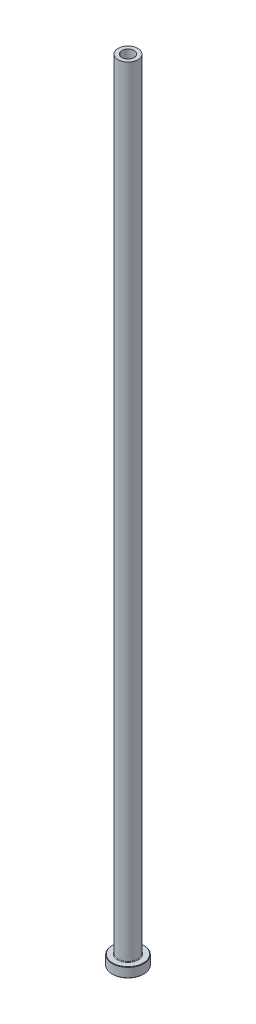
SolidWorks part; units mm, degrees
ref_plane "Front Plane" through (0, 0, 0) normal (0, 0, 1) x (1, 0, 0)
ref_plane "Top Plane" through (0, 0, 0) normal (0, 1, 0) x (1, 0, 0)
ref_plane "Right Plane" through (0, 0, 0) normal (1, 0, 0) x (0, 0, -1)
sketch "Sketch1" plane through (0, 0, 0) normal (0, 0, 1) x (1, 0, 0)
  line L0 (-3.1, 400) -> (-5, 400)
  line L1 (-5, 400) -> (-5, 5)
  line L2 (-5, 5) -> (-8, 5)
  line L3 (-8, 5) -> (-8, 0)
  line L4 (8.8, 0) -> (-8.8, 0) construction
  line L5 (-8, 0) -> (-3.35, 0)
  line L6 (-3.1, 355) -> (-3.1, 400)
  line L7 (0, 92.1877) -> (0, -15.5353) construction
  line L8 (0, -8.8) -> (0, 8.8) construction
  line L9 (-3.1, 355) -> (-3.35, 343)
  line L10 (-3.35, 343) -> (-3.35, 0)
  dimension "D1" = 0.25
  dimension "ID" = 6.2
  dimension "OD" = 10
  dimension "L" = 400
  dimension "H" = 16
  dimension "T" = 5
  dimension "N" = 45
  dimension "D2" = 12
revolve "Revolve1" add sketch "Sketch1" angle 360 about L7
fillet "Fillet1" radius 0.3 1 edges at (0, 5, 5)
chamfer "Chamfer1" distance 0.2 angle 45 2 edges at (0, 5, 8) (0, 0, 8)
chamfer "Chamfer3" distance 0.5 angle 45 1 edges at (0, 0, 3.35)
